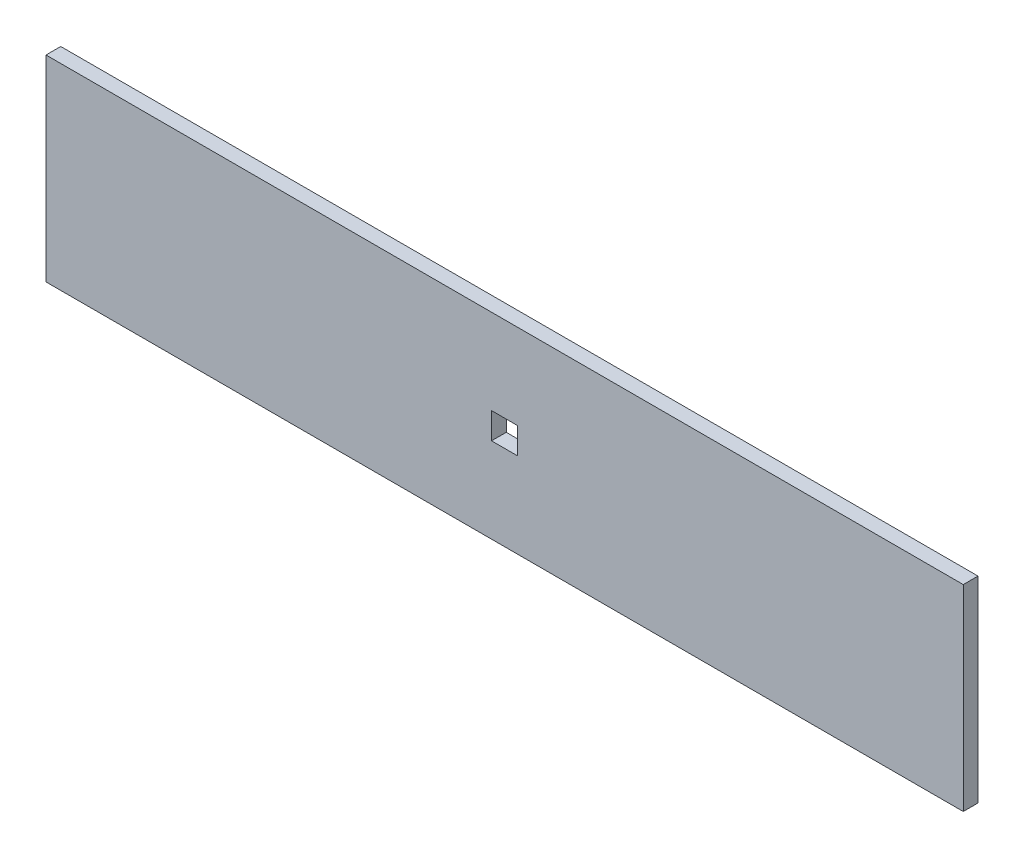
SolidWorks part; units mm, degrees
ref_plane "Front Plane" through (0, 0, 0) normal (0, 0, 1) x (1, 0, 0)
ref_plane "Top Plane" through (0, 0, 0) normal (0, 1, 0) x (1, 0, 0)
ref_plane "Right Plane" through (0, 0, 0) normal (1, 0, 0) x (0, 0, -1)
sketch "Sketch1" plane through (0, 0, 0) normal (0, 0, 1) x (1, 0, 0)
  line L1 (140, -30) -> (-140, -30)
  line L2 (140, -30) -> (140, 30)
  line L3 (140, 30) -> (-140, 30)
  line L4 (-140, -30) -> (-140, 30)
  line L5 (140, -30) -> (-140, 30) construction
  line L6 (140, 30) -> (-140, -30) construction
  point P0 (0, 0)
  dimension "D1" = 280
  dimension "D2" = 60
extrude "Boss-Extrude1" add sketch "Sketch1" along normal blind 4.5
sketch "Sketch2" plane through (0, 0, 4.5) normal (0, 0, 1) x (1, 0, 0)
  line L1 (4, -4) -> (-4, -4)
  line L2 (4, -4) -> (4, 4)
  line L3 (4, 4) -> (-4, 4)
  line L4 (-4, -4) -> (-4, 4)
  line L5 (4, -4) -> (-4, 4) construction
  line L6 (4, 4) -> (-4, -4) construction
  point P0 (0, 0)
  dimension "D1" = 8
extrude "Cut-Extrude1" cut sketch "Sketch2" against normal through all
